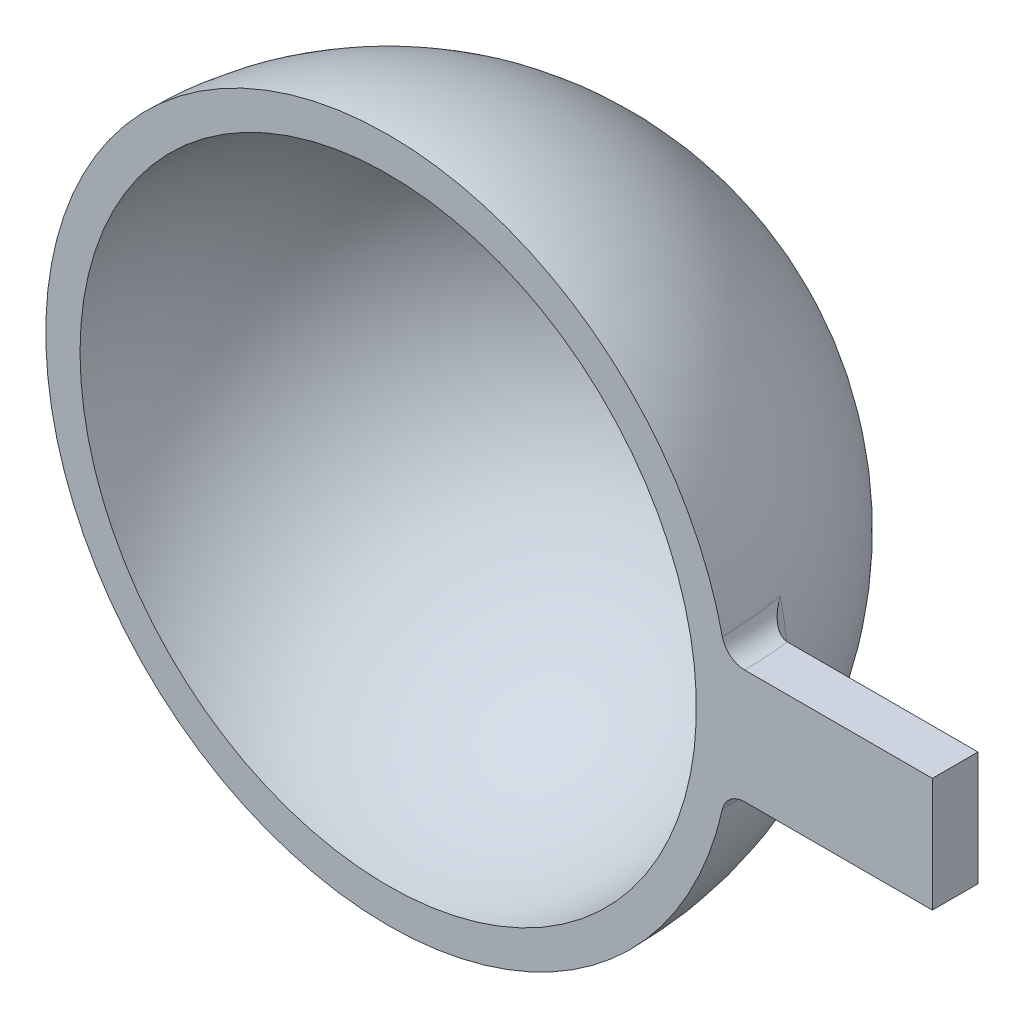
SolidWorks part; units mm, degrees
ref_plane "Plan de face" through (0, 0, 0) normal (0, 0, 1) x (1, 0, 0)
ref_plane "Plan de dessus" through (0, 0, 0) normal (0, 1, 0) x (1, 0, 0)
ref_plane "Plan de droite" through (0, 0, 0) normal (1, 0, 0) x (0, 0, -1)
sketch "Esquisse1" plane through (0, 0, 0) normal (0, 0, 1) x (1, 0, 0)
  line L0 (0, 18) -> (0, -18) construction
  line L2 (0, 15) -> (0, 13.5)
  line L3 (0, -13.5) -> (0, -15)
  arc A0 (0, 15) -> (0, -15) centre (0, 0) ccw
  arc A1 (0, 13.5) -> (0, -13.5) centre (0, 0) ccw
  dimension "D3" = 15
  dimension "D1" = 18
  dimension "D2" = 18
  dimension "D4" = 1.5
revolve "Révolution1" add sketch "Esquisse1" angle 180 about L0
sketch "Esquisse2" plane through (0, 0, 0) normal (0, 0, 1) x (1, 0, 0)
  line L0 (0, 0) -> (26.248, 0) construction
  line L2 (13.5189, 2.5) -> (23.8355, 2.5)
  line L3 (13.5189, 2.5) -> (13.5189, -2.5)
  line L4 (13.5189, -2.5) -> (23.8355, -2.5)
  line L5 (23.8355, 2.5) -> (23.8355, -2.5)
  dimension "D1" = 2.5
  dimension "D2" = 2.5
extrude "Boss.-Extru.1" add sketch "Esquisse2" against normal blind 2
fillet "Congé1" radius 1 3 edges at (14.7562, -2.5, -1.0023) (14.8661, 0, -2) (14.7562, 2.5, -1.0023)
